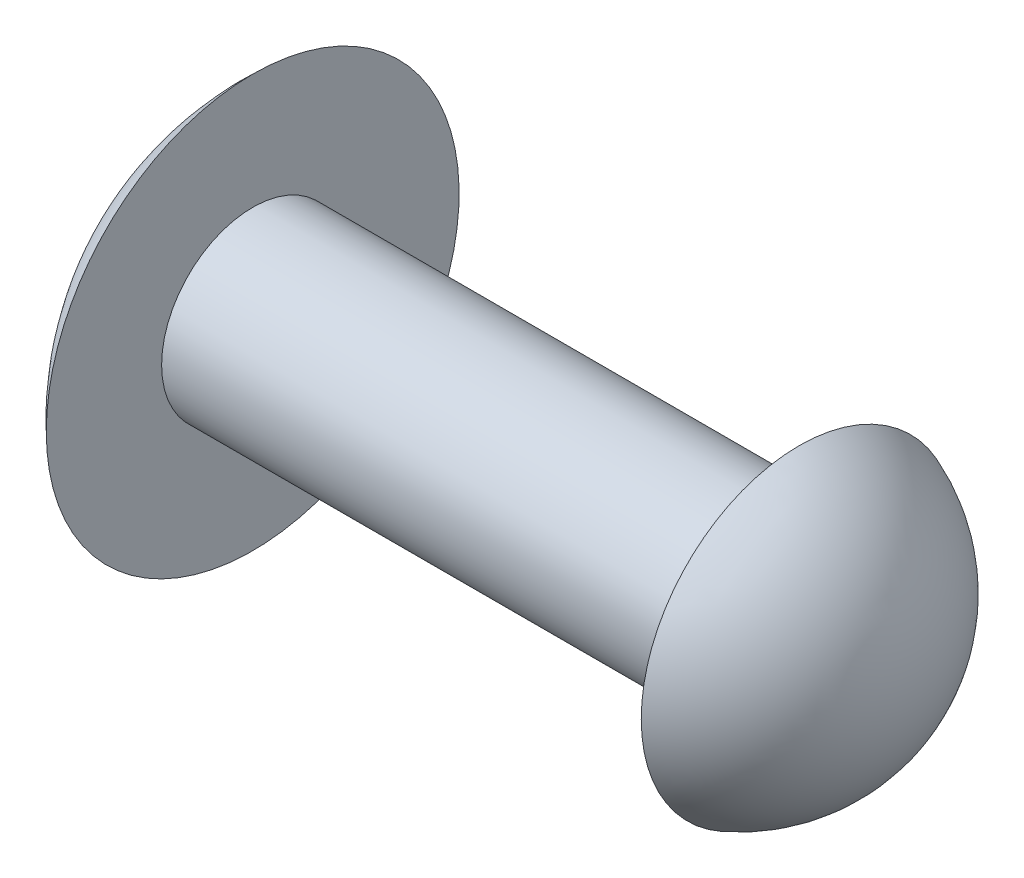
SolidWorks part; units mm, degrees
ref_plane "Plane1" through (0, 0, 0) normal (0, 0, 1) x (1, 0, 0)
ref_plane "Plane2" through (0, 0, 0) normal (0, 1, 0) x (1, 0, 0)
ref_plane "Plane3" through (0, 0, 0) normal (1, 0, 0) x (0, 0, -1)
revolve "Base-Revolve" add sketch "Sketch1" angle 360 about L0
sketch "Sketch1" plane through (0, 0, 0) normal (0, 0, 1) x (1, 0, 0)
  line L0 (-39, 0) -> (6, 0) construction
  line L1 (-10.5, 0) -> (0, 0)
  line L2 (-9, 1.5) -> (-9, 3.4)
  line L3 (-9, 1.5) -> (0, 1.5)
  line L4 (0, 1.5) -> (0, 0)
  arc A0 (-9, 3.4) -> (-10.5, 0) centre (-5.8967, 0) ccw
  point P12 (-9, 1.5)
  dimension "Diameter" = 3
  dimension "GripLength" = 9
  dimension "HeadHt" = 1.5
  dimension "HeadDia" = 6.8
sketch "Sketch2" plane through (0, 0, 0) normal (0, 0, 1) x (1, 0, 0)
  line L0 (-49, 0) -> (71, 0) construction
  line L1 (0, 0) -> (1.8, 0)
  line L2 (0, 0) -> (0, 2.6)
  arc A0 (1.8, 0) -> (0, 2.6) centre (-0.9778, 0) ccw
  dimension "HeadDiaA" = 5.2
  dimension "HeadHtA" = 1.8
revolve "HeadTypeA" add sketch "Sketch2" angle 360 about L0
sketch "Sketch3" plane through (0, 0, 0) normal (0, 0, 1) x (1, 0, 0)
  line L0 (30, 0) -> (-54, 0) construction
  line L1 (-39, 0) -> (6, 0) construction
  line L2 (0, 0) -> (0, 2.6)
  line L3 (0, 2.6) -> (-1.4335, 1.5)
  line L4 (-1.4335, 0) -> (0, 0)
  line L5 (0, -2.6) -> (-1.4335, -1.5) construction
  line L6 (-1.4335, 0) -> (-1.4335, 1.5)
  dimension "HeadDiaB" = 5.2
  dimension "D2" = 75
  dimension "D3" = 3
revolve "HeadTypeB" [suppressed] add sketch "Sketch3" angle 360 about L0
equation "\"D3@Sketch3\" = \"Diameter@Sketch1\""
